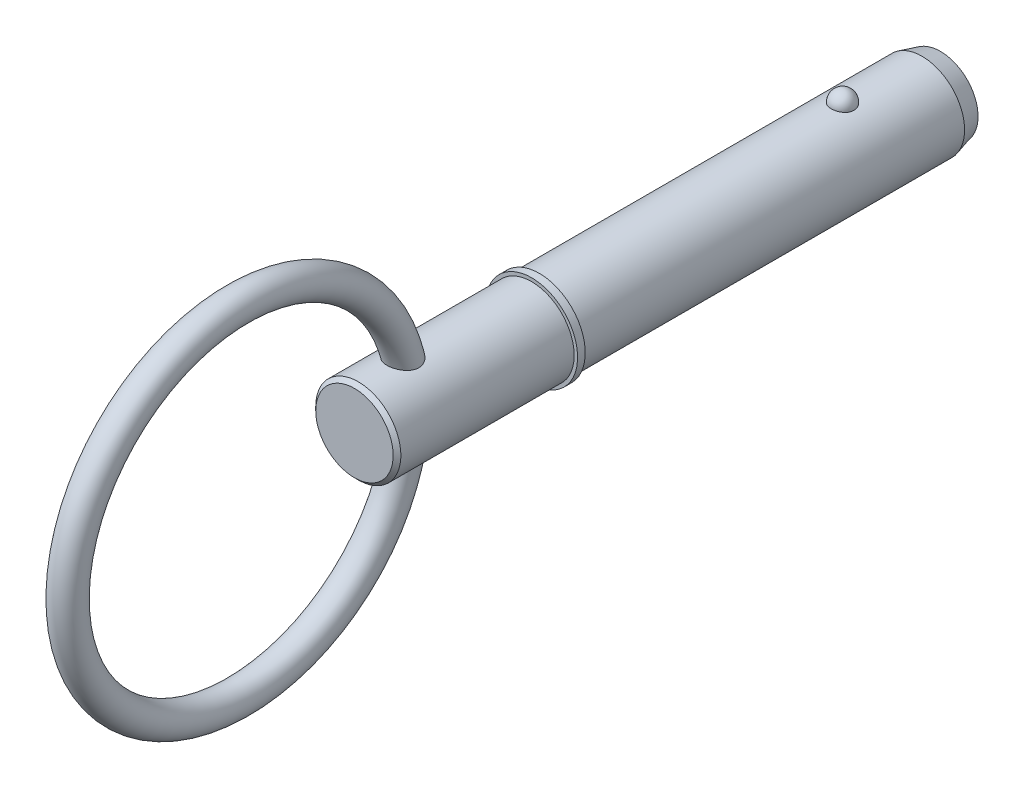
SolidWorks part; units mm, degrees
ref_plane "Front Plane" through (0, 0, 0) normal (0, 0, 1) x (1, 0, 0)
ref_plane "Top Plane" through (0, 0, 0) normal (0, 1, 0) x (1, 0, 0)
ref_plane "Right Plane" through (0, 0, 0) normal (1, 0, 0) x (0, 0, -1)
sketch "Sketch2" plane through (0, 0, 0) normal (0, 0, 1) x (1, 0, 0)
  circle A0 centre (0, 0) radius 5.555
  point P3 (0, 5.555)
  dimension "D1" = 11.11
extrude "Boss-Extrude1" add sketch "Sketch2" along normal blind 38.1
sketch "Sketch3" plane through (0, 0, 0) normal (0, 0, -1) x (-1, 0, 0)
  circle A0 centre (0, 0) radius 5.555
  dimension "D1" = 11.11
extrude "Boss-Extrude2" add sketch "Sketch3" along normal blind 14.27
chamfer "Chamfer1" distance 2.4 angle 15 1 edges at (-5.555, 0, -14.27)
sketch "Sketch18" plane through (0, 0, 0) normal (1, 0, 0) x (0, 0, -1)
  line L0 (11.87, 5.555) -> (-38.1, 5.555) construction
  line L1 (1.49, 7.045) -> (1.49, 4.065)
  line L2 (-38.1, -5.555) -> (11.87, -5.555) construction
  arc A0 (1.49, 7.045) -> (1.49, 4.065) centre (1.49, 5.555) ccw
  point P4 (0, 5.555)
  dimension "D1" = 12.6
revolve "Revolve1" add sketch "Sketch18" angle 360 about L1
sketch "Sketch19" plane through (0, 0, 0) normal (1, 0, 0) x (0, 0, -1)
  line L0 (-33.7288, 0) -> (-46.4542, 0) construction
sketch "Sketch20" plane through (0, 0, 0) normal (1, 0, 0) x (0, 0, -1)
  line L0 (-38.1, 0) -> (-38.1, 6)
  line L1 (-38.1, 5.555) -> (-38.1, -5.555) construction
  line L2 (-38.1, 6) -> (-39.1, 6)
  line L3 (-39.1, 6) -> (-39.1, 0)
  line L4 (-33.7288, 0) -> (-46.4542, 0) construction
  line L5 (-39.1, 0) -> (-38.1, 0)
  dimension "D1" = 6
  dimension "D2" = 1
revolve "Revolve2" add sketch "Sketch20" angle 360 about L0
sketch "Sketch21" plane through (0, 0, 38.1) normal (0, 0, -1) x (-1, 0, 0)
  circle A0 centre (0, 0) radius 5.555
  dimension "D1" = 11.11
extrude "Boss-Extrude3" add sketch "Sketch21" against normal blind 24.13
chamfer "Chamfer2" distance 0.5 angle 45 1 edges at (-5.555, 0, 62.23)
sketch "Sketch23" plane through (0, 0, 0) normal (1, 0, 0) x (0, 0, -1)
  line L0 (-62.23, 5.055) -> (-62.23, -5.055) construction
  circle A0 centre (-77.455, 0) radius 22.225
  point P2 (-55.23, 0)
  dimension "D1" = 44.45
  dimension "D2" = 7
sketch "Sketch24" plane through (0, 0, 0) normal (0, 1, 0) x (1, 0, 0)
  circle A0 centre (0, -55.23) radius 2
  dimension "D1" = 4
sweep "Sweep1" add profiles "Sketch24" path "Sketch23"
